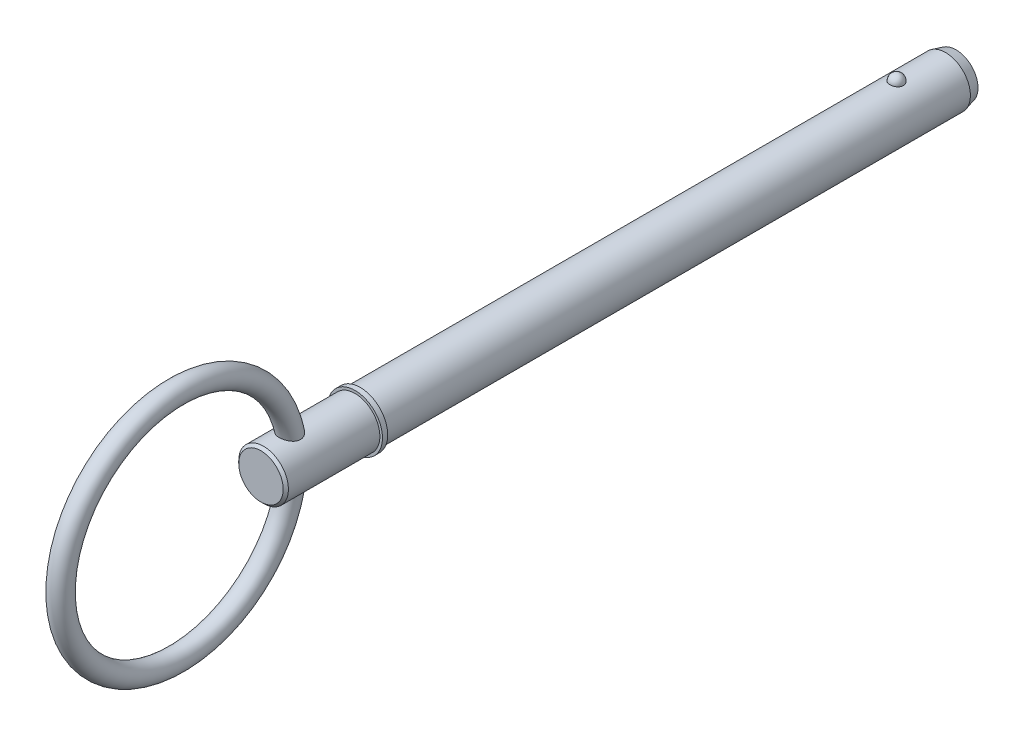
SolidWorks part; units mm, degrees
ref_plane "Front Plane" through (0, 0, 0) normal (0, 0, 1) x (1, 0, 0)
ref_plane "Top Plane" through (0, 0, 0) normal (0, 1, 0) x (1, 0, 0)
ref_plane "Right Plane" through (0, 0, 0) normal (1, 0, 0) x (0, 0, -1)
sketch "Sketch2" plane through (0, 0, 0) normal (0, 0, 1) x (1, 0, 0)
  circle A0 centre (0, 0) radius 4.765
  point P3 (0, 4.765)
  dimension "D1" = 9.53
extrude "Boss-Extrude1" add sketch "Sketch2" along normal blind 101.6
sketch "Sketch3" plane through (0, 0, 0) normal (0, 0, -1) x (-1, 0, 0)
  circle A0 centre (0, 0) radius 4.765
  dimension "D1" = 9.53
extrude "Boss-Extrude2" add sketch "Sketch3" along normal blind 12.7
chamfer "Chamfer1" distance 2 angle 15 1 edges at (-4.765, 0, -12.7)
sketch "Sketch18" plane through (0, 0, 0) normal (1, 0, 0) x (0, 0, -1)
  line L0 (10.7, 4.765) -> (-101.6, 4.765) construction
  line L1 (1.29, 6.055) -> (1.29, 3.475)
  line L2 (-101.6, -4.765) -> (10.7, -4.765) construction
  arc A0 (1.29, 6.055) -> (1.29, 3.475) centre (1.29, 4.765) ccw
  point P4 (0, 4.765)
  dimension "D1" = 10.82
revolve "Revolve1" add sketch "Sketch18" angle 360 about L1
sketch "Sketch19" plane through (0, 0, 0) normal (1, 0, 0) x (0, 0, -1)
  line L0 (-33.7288, 0) -> (-46.4542, 0) construction
sketch "Sketch20" plane through (0, 0, 0) normal (1, 0, 0) x (0, 0, -1)
  line L0 (-101.6, 0) -> (-101.6, 5.265)
  line L1 (-101.6, 4.765) -> (-101.6, -4.765) construction
  line L2 (-101.6, 5.265) -> (-102.6, 5.265)
  line L3 (-102.6, 5.265) -> (-102.6, 0)
  line L4 (-33.7288, 0) -> (-46.4542, 0) construction
  line L5 (-102.6, 0) -> (-101.6, 0)
  dimension "D1" = 5.265
  dimension "D2" = 1
revolve "Revolve2" add sketch "Sketch20" angle 360 about L0
sketch "Sketch21" plane through (0, 0, 101.6) normal (0, 0, -1) x (-1, 0, 0)
  circle A0 centre (0, 0) radius 4.765
  dimension "D1" = 9.53
extrude "Boss-Extrude3" add sketch "Sketch21" against normal blind 19.05
chamfer "Chamfer2" distance 0.5 angle 45 1 edges at (-4.765, 0, 120.65)
sketch "Sketch23" plane through (0, 0, 0) normal (1, 0, 0) x (0, 0, -1)
  line L0 (-120.65, 4.265) -> (-120.65, -4.265) construction
  circle A0 centre (-136.875, 0) radius 22.225
  point P2 (-114.65, 0)
  dimension "D1" = 44.45
  dimension "D2" = 6
sketch "Sketch24" plane through (0, 0, 0) normal (0, 1, 0) x (1, 0, 0)
  circle A0 centre (0, -114.65) radius 2
  dimension "D1" = 4
sweep "Sweep1" add profiles "Sketch24" path "Sketch23"
